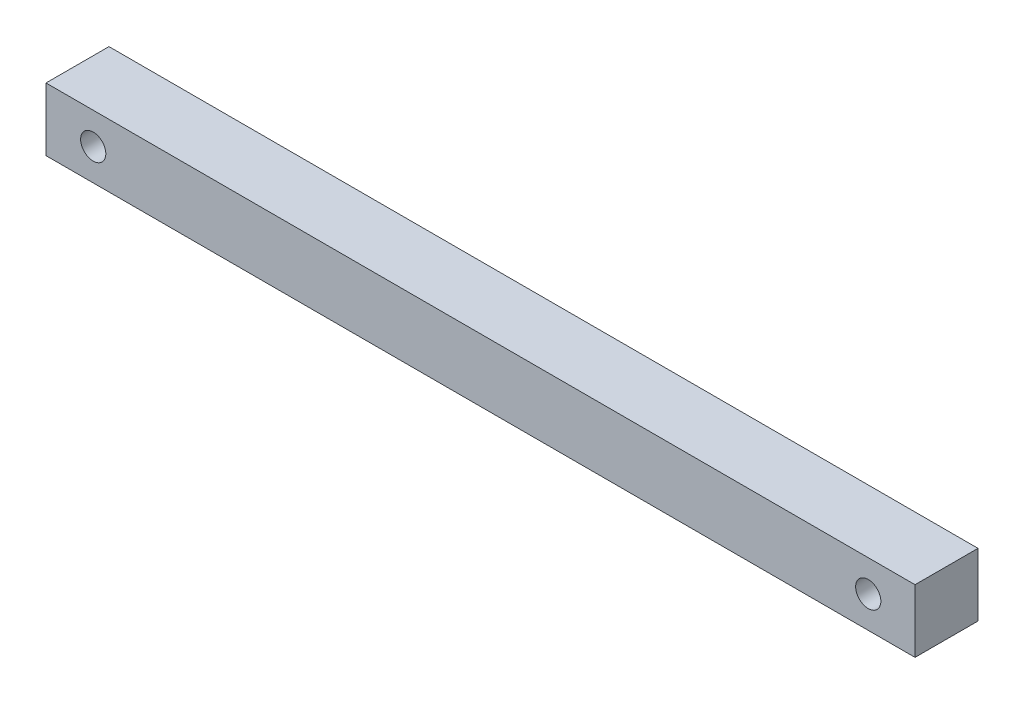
SolidWorks part; units mm, degrees
ref_plane "Front Plane" through (0, 0, 0) normal (0, 0, 1) x (1, 0, 0)
ref_plane "Top Plane" through (0, 0, 0) normal (0, 1, 0) x (1, 0, 0)
ref_plane "Right Plane" through (0, 0, 0) normal (1, 0, 0) x (0, 0, -1)
sketch "Sketch1" plane through (0, 0, 0) normal (0, 0, 1) x (1, 0, 0)
  line L1 (-34, 2.5) -> (35, 2.5)
  line L2 (-34, 2.5) -> (-34, -2.5)
  line L3 (-34, -2.5) -> (35, -2.5)
  line L4 (35, 2.5) -> (35, -2.5)
extrude "Boss-Extrude1" add sketch "Sketch1" along normal blind 5
sketch "Sketch2" plane through (0, 0, 5) normal (0, 0, 1) x (1, 0, 0)
  circle A0 centre (-30.2512, 0) radius 1
  circle A1 centre (31.285, 0) radius 1
  dimension "D1" = 61.5362
extrude "Cut-Extrude1" cut sketch "Sketch2" against normal blind 5
